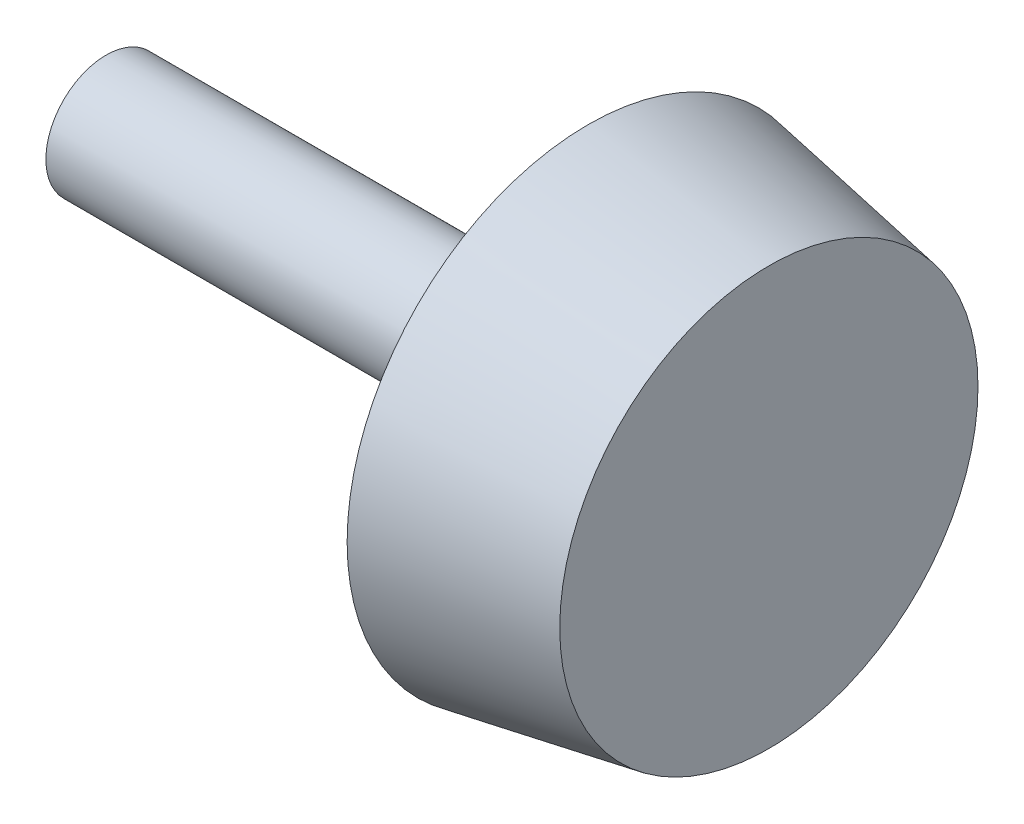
SolidWorks part; units mm, degrees
ref_plane "Front Plane" through (0, 0, 0) normal (0, 0, 1) x (1, 0, 0)
ref_plane "Top Plane" through (0, 0, 0) normal (0, 1, 0) x (1, 0, 0)
ref_plane "Right Plane" through (0, 0, 0) normal (1, 0, 0) x (0, 0, -1)
sketch "Sketch1" plane through (0, 0, 0) normal (1, 0, 0) x (0, 0, -1)
  circle A0 centre (0, 0) radius 3.175
  dimension "D1" = 6.35
extrude "Boss-Extrude1" add sketch "Sketch1" along normal blind 25.4
sketch "Sketch2" plane through (25.4, 0, 0) normal (1, 0, 0) x (0, 0, -1)
  circle A0 centre (0, 0) radius 12.7
  dimension "D1" = 25.4
extrude "Boss-Extrude2" add sketch "Sketch2" along normal blind 9.525 draft 10
